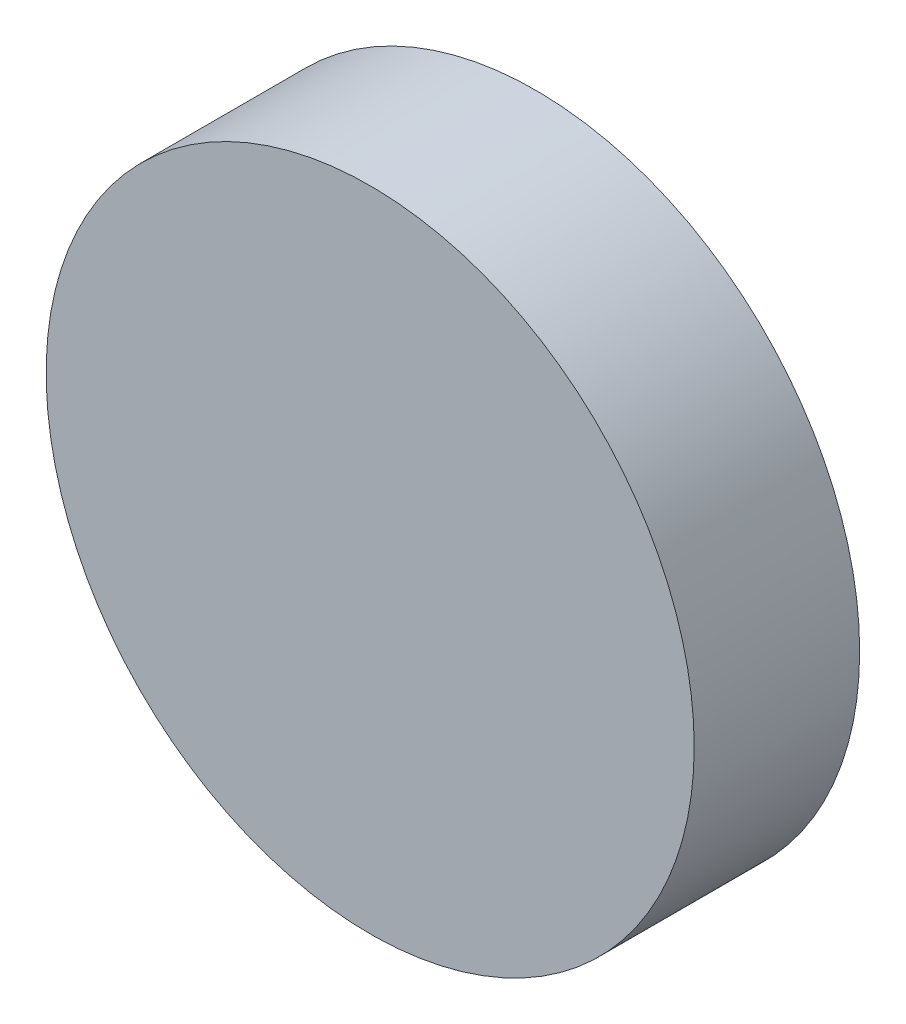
SolidWorks part; units mm, degrees
ref_plane "Front Plane" through (0, 0, 0) normal (0, 0, 1) x (1, 0, 0)
ref_plane "Top Plane" through (0, 0, 0) normal (0, 1, 0) x (1, 0, 0)
ref_plane "Right Plane" through (0, 0, 0) normal (1, 0, 0) x (0, 0, -1)
sketch "Sketch1" plane through (0, 0, 0) normal (0, 0, 1) x (1, 0, 0)
  circle A1 centre (0, 0) radius 23.5
  dimension "D2" = 47
extrude "Boss-Extrude1" add sketch "Sketch1" along normal blind 5 and the other way blind 7
sketch "Sketch2" plane through (0, 0, -7) normal (0, 0, -1) x (-1, 0, 0)
  circle A0 centre (0, 0) radius 18.5
  circle A1 centre (0, 0) radius 13.25
  dimension "D1" = 26.5
  dimension "3" = 37
extrude "Boss-Extrude2" add sketch "Sketch2" along normal blind 1.5
sketch "Sketch3" plane through (0, 0, -7) normal (0, 0, -1) x (-1, 0, 0)
  circle A0 centre (0, 0) radius 7.95
  circle A1 centre (0, 0) radius 13.25 construction
  dimension "D1" = 15.9
extrude "Cut-Extrude1" cut sketch "Sketch3" against normal blind 7
